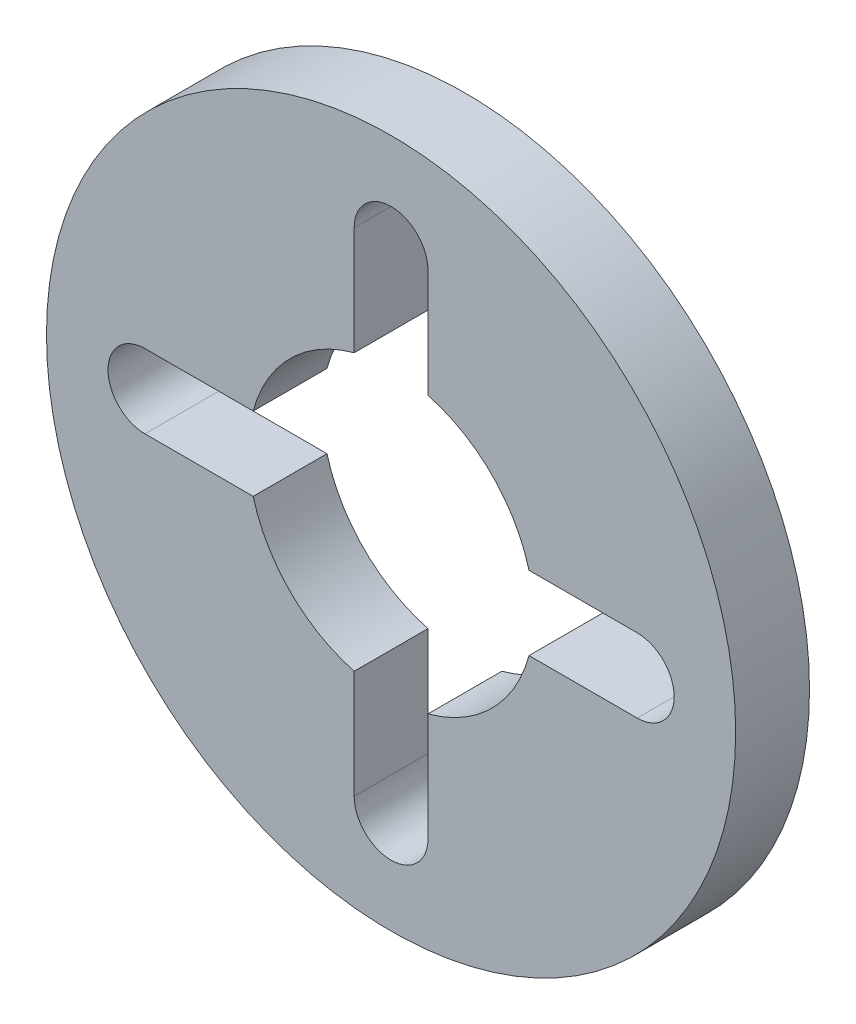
SolidWorks part; units mm, degrees
ref_plane "Спереди" through (0, 0, 0) normal (0, 0, 1) x (1, 0, 0)
ref_plane "Сверху" through (0, 0, 0) normal (0, 1, 0) x (1, 0, 0)
ref_plane "Справа" through (0, 0, 0) normal (1, 0, 0) x (0, 0, -1)
sketch "Эскиз1" plane through (0, 0, 0) normal (0, 0, 1) x (1, 0, 0)
  line L0 (0, 9.0243) -> (0, -10.3343) construction
  line L1 (-10.959, 0) -> (11.2325, 0) construction
  line L2 (2.8013, 0.75) -> (5, 0.75)
  line L3 (2.8013, -0.75) -> (5, -0.75)
  line L4 (-0.75, 5) -> (-0.75, 2.8013)
  line L5 (0.75, -2.8013) -> (0.75, -5)
  line L6 (0.75, 5) -> (0.75, 2.8013)
  line L7 (-5, 0.75) -> (-2.8013, 0.75)
  line L9 (-5, -0.75) -> (-2.8013, -0.75)
  line L11 (-0.75, -2.8013) -> (-0.75, -5)
  circle A0 centre (0, 0) radius 7
  arc A1 (-2.8013, -0.75) -> (-0.75, -2.8013) centre (0, 0) ccw
  arc A2 (-5, 0.75) -> (-5, -0.75) centre (-5, 0) ccw
  arc A3 (5, -0.75) -> (5, 0.75) centre (5, 0) ccw
  arc A4 (0.75, 5) -> (-0.75, 5) centre (0, 5) ccw
  arc A5 (-0.75, -5) -> (0.75, -5) centre (0, -5) ccw
  arc A6 (-0.75, 2.8013) -> (-2.8013, 0.75) centre (0, 0) ccw
  arc A7 (0.75, -2.8013) -> (2.8013, -0.75) centre (0, 0) ccw
  arc A8 (2.8013, 0.75) -> (0.75, 2.8013) centre (0, 0) ccw
  dimension "D1" = 14
  dimension "D2" = 5.8
  dimension "D3" = 10
  dimension "D4" = 10
  dimension "D5" = 5
  dimension "D6" = 5
  dimension "D9" = 0.75
  dimension "D10" = 0.75
extrude "Бобышка-Вытянуть1" add sketch "Эскиз1" along normal blind 1.5
